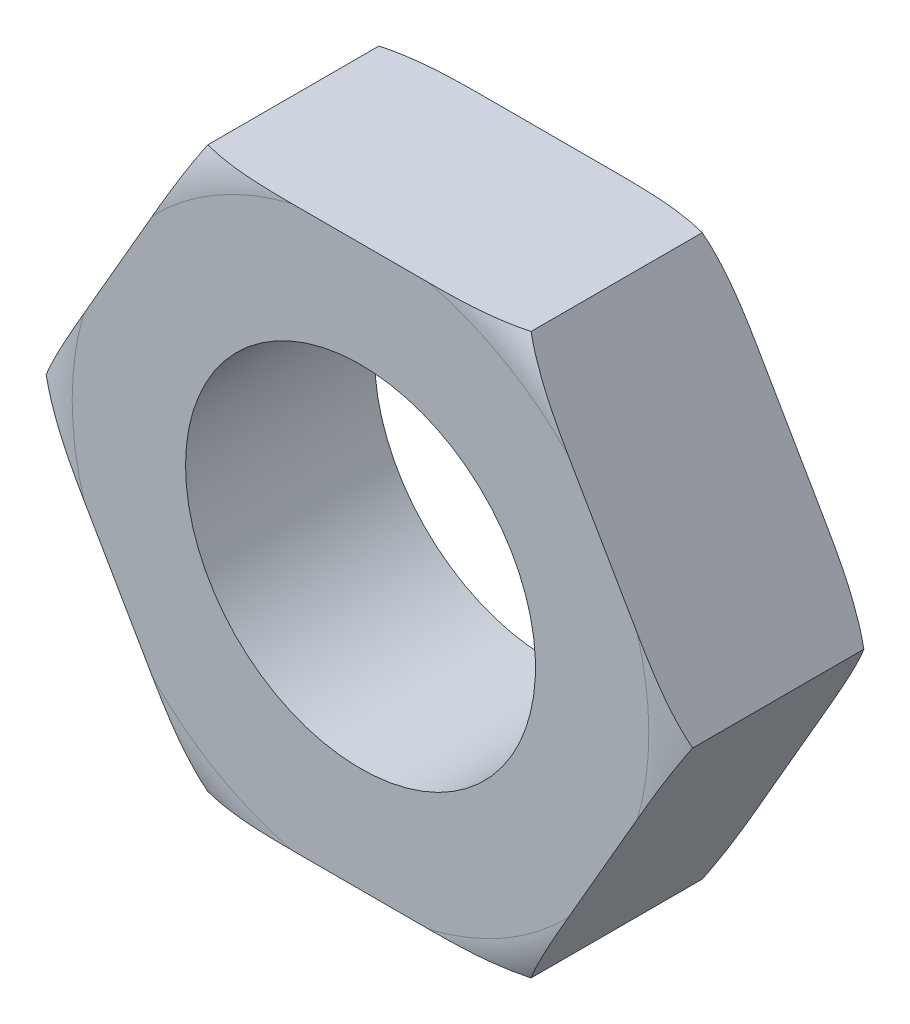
SolidWorks part; units mm, degrees
ref_plane "Front Plane" through (0, 0, 0) normal (0, 0, 1) x (1, 0, 0)
ref_plane "Top Plane" through (0, 0, 0) normal (0, 1, 0) x (1, 0, 0)
ref_plane "Right Plane" through (0, 0, 0) normal (1, 0, 0) x (0, 0, -1)
sketch "Sketch1" plane through (0, 0, 0) normal (0, 0, 1) x (1, 0, 0)
  line L1 (4.6188, 0) -> (2.3094, 4)
  line L2 (2.3094, 4) -> (-2.3094, 4)
  line L3 (-2.3094, 4) -> (-4.6188, 0)
  line L4 (-4.6188, 0) -> (-2.3094, -4)
  line L5 (-2.3094, -4) -> (2.3094, -4)
  line L6 (2.3094, -4) -> (4.6188, 0)
  circle A0 centre (0, 0) radius 4 construction
  circle A1 centre (0, 0) radius 2.5
  dimension "D2" = 5
  dimension "D1" = 8
extrude "Boss-Extrude1" add sketch "Sketch1" along normal blind 2.7
ref_axis "Axis1" through (0, 0, 2.7) along (0, 0, -1)
ref_plane "Plane1" through (0, 0, 0) normal (0, -1, 0) x (1, 0, 0)
sketch "Sketch2" plane through (0, 0, 0) normal (0, -1, 0) x (1, 0, 0)
  line L1 (-2.3094, 2.7) -> (-4.6188, 2.7) construction
  line L7 (-4.1194, 2.7) -> (-4.6188, 2.7)
  line L12 (-4.6188, 2.7) -> (-4.6188, 0) construction
  line L13 (-4.6188, 2.573) -> (-4.6188, 2.7)
  arc A0 (-4.1194, 2.7) -> (-4.6188, 2.573) centre (-4.1194, 1.6546) ccw
  dimension "D1" = 0.127
revolve "Cut-Revolve1" cut sketch "Sketch2" angle 360 about axis through (0, 0, 2.7) along (0, 0, -1)
ref_plane "Plane2" through (0, 0, 1.35) normal (0, 0, -1) x (-1, 0, 0)
mirror "Mirror1" about plane through (0, 0, 1.35) normal (0, 0, -1) of "Cut-Revolve1"
